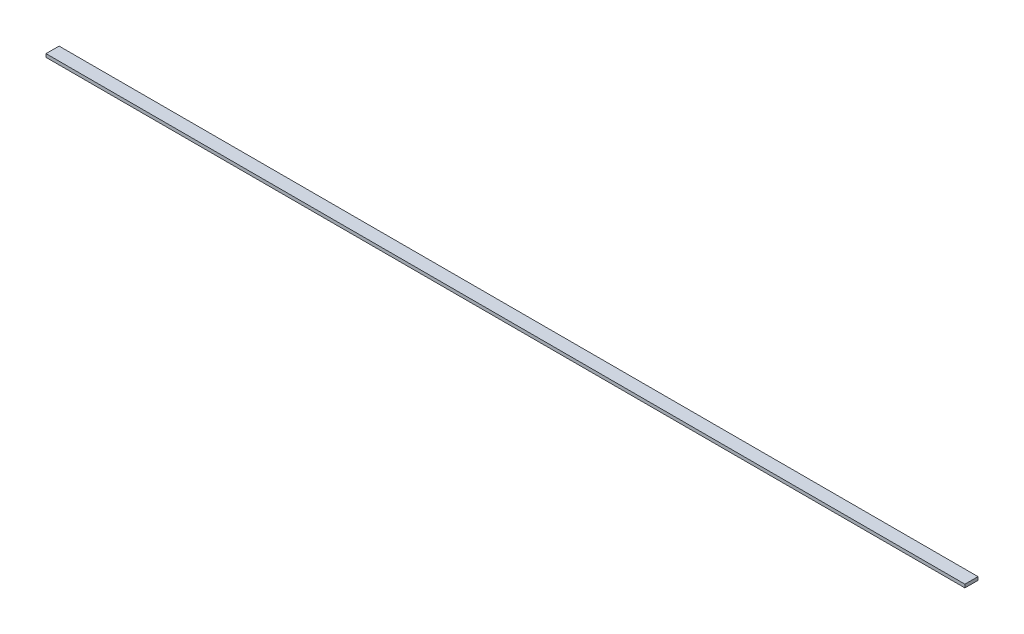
SolidWorks part; units mm, degrees
ref_plane "Front Plane" through (0, 0, 0) normal (0, 0, 1) x (1, 0, 0)
ref_plane "Top Plane" through (0, 0, 0) normal (0, 1, 0) x (1, 0, 0)
ref_plane "Right Plane" through (0, 0, 0) normal (1, 0, 0) x (0, 0, -1)
sketch "Sketch1" plane through (0, 0, 0) normal (0, 1, 0) x (1, 0, 0)
  line L1 (-892.175, -12.7) -> (892.175, -12.7)
  line L2 (-892.175, -12.7) -> (-892.175, 12.7)
  line L3 (-892.175, 12.7) -> (892.175, 12.7)
  line L4 (892.175, -12.7) -> (892.175, 12.7)
  line L5 (-892.175, -12.7) -> (892.175, 12.7) construction
  line L6 (-892.175, 12.7) -> (892.175, -12.7) construction
  point P0 (0, 0)
extrude "Boss-Extrude1" add sketch "Sketch1" along normal blind 6.35
equation "\"horizontal-component-length\"= \"railing-hypotenuse\" - \"railing-hypotenuse-horizontal-component-length-difference\""
equation "\"horizontal-component-width\"= 1in"
equation "\"D1@Sketch1\"=\"horizontal-component-length\""
equation "\"D2@Sketch1\"=\"horizontal-component-width\""
equation "\"material-thickness\"= .25in"
equation "\"D1@Boss-Extrude1\"=\"material-thickness\""
equation "\"railing-hypotenuse\"= 72in"
equation "\"railing-hypotenuse-horizontal-component-length-difference\"= 1.75in"
